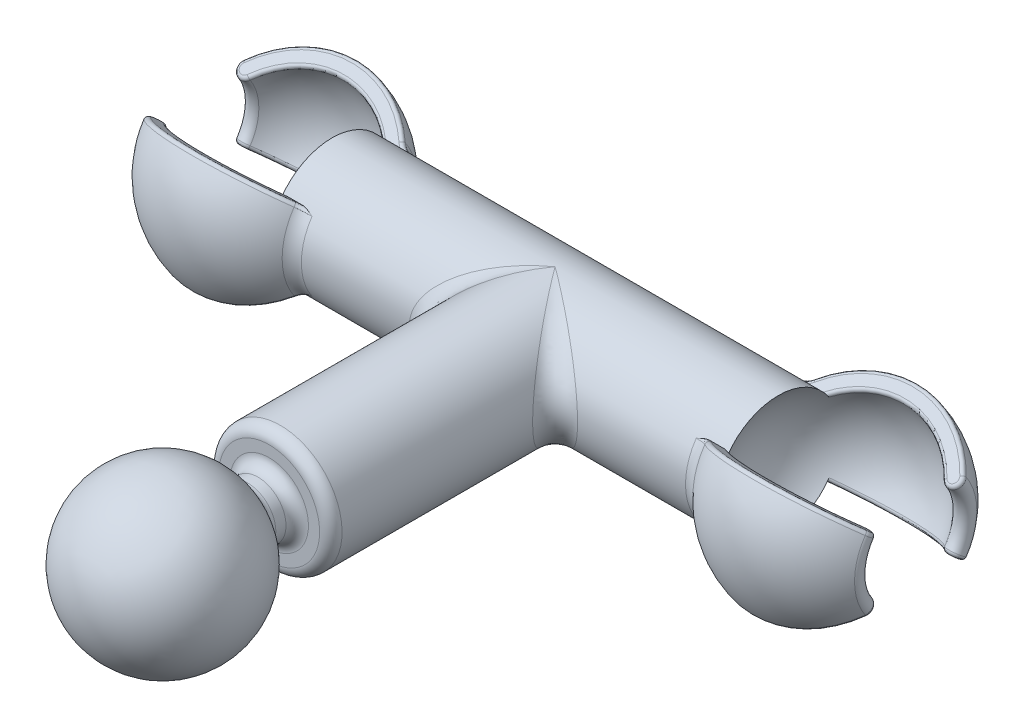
SolidWorks part; units mm, degrees
ref_plane "Front" through (0, 0, 0) normal (0, 0, 1) x (1, 0, 0)
ref_plane "Top" through (0, 0, 0) normal (0, 1, 0) x (1, 0, 0)
ref_plane "Right" through (0, 0, 0) normal (1, 0, 0) x (0, 0, -1)
sketch "Sketch1" plane through (0, 0, 0) normal (0, 0, 1) x (1, 0, 0)
  line L1 (9.525, 0) -> (31.75, 0)
  line L2 (31.75, 6.985) -> (31.75, 0)
  line L6 (6.4758, 6.985) -> (31.75, 6.985)
  line L7 (0, 0) -> (31.75, 0) construction
  arc A0 (6.4758, 6.985) -> (9.525, 0) centre (0, 0) cw
  dimension "D3" = 22.225
  dimension "D2" = 9.525
  dimension "D1" = 6.985
revolve "Revolve2" add sketch "Sketch1" angle 360 about L7
ref_plane "Plane3" through (31.75, 0, 0) normal (1, 0, 0) x (0, 0, -1)
sketch "Sketch2" plane through (31.75, 0, 31.75) normal (1, 0, 0) x (0, 0, -1)
  line L0 (31.75, 0) -> (31.75, 13.97) construction
  line L1 (-22.0472, 0) -> (31.75, 0)
  line L2 (-3.0581, 3.175) -> (-1.905, 3.175)
  line L3 (31.75, 6.985) -> (31.75, 0)
  line L4 (-0.635, 4.445) -> (-0.635, 5.715)
  line L6 (0.635, 6.985) -> (31.75, 6.985)
  line L7 (-12.7, 0) -> (76.1055, 0) construction
  line L8 (31.75, 50) -> (31.75, -50) construction
  line L9 (81.75, 0) -> (-18.25, 0) construction
  arc A0 (-4.2114, 3.9133) -> (-22.0472, 0) centre (-12.7, 0) ccw
  arc A2 (-3.0581, 3.175) -> (-4.2114, 3.9133) centre (-3.0581, 4.445) cw
  arc A3 (-1.905, 3.175) -> (-0.635, 4.445) centre (-1.905, 4.445) ccw
  arc A4 (-0.635, 5.715) -> (0.635, 6.985) centre (0.635, 5.715) cw
  point P16 (8.7914, 3.175)
  point P20 (12.065, 3.175)
  point P23 (12.065, 6.985)
  point P36 (31.75, 0)
  dimension "D3" = 1.27
  dimension "D6" = 12.065
  dimension "D1" = 9.3472
  dimension "D2" = 6.985
  dimension "D4" = 3.175
  dimension "D5" = 44.45
revolve "Revolve3" add sketch "Sketch2" angle 360 about L7
sketch "Sketch3" plane through (0, 0, 0) normal (0, 1, 0) x (1, 0, 0)
  line L0 (31.75, 6.985) -> (6.4758, 6.985) construction
  line L1 (6.4758, 6.985) -> (9.0474, 6.985)
  line L2 (0, 0) -> (25.7797, 0) construction
  arc A0 (6.4758, -6.985) -> (6.4758, 6.985) centre (0, 0) ccw construction
  arc A1 (6.4758, 6.985) -> (-7.5764, 5.7727) centre (0, 0) ccw
  arc A2 (9.0474, 6.985) -> (-9.0916, 6.9273) centre (0, 0) ccw
  arc A3 (-7.5764, 5.7727) -> (-9.0916, 6.9273) centre (-8.334, 6.35) cw
  dimension "D1" = 11.43
  dimension "D2" = 6.35
revolve "Revolve4" add sketch "Sketch3" angle 75 about L2
mirror "Mirror1" about plane through (0, 0, 0) normal (0, 0, 1) of "Revolve4"
fillet "Fillet5" radius 2.032 2 edges at (9.0474, 0, -6.985) (9.0474, 0, 6.985)
fillet "Fillet3" radius 0.381 16 edges at (9.1703, 4.3589, 5.6806) (-0.4734, 6.9522, 9.0602) (-8.9113, 3.4044, 4.4367) (9.1703, -4.3589, 5.6806) (-0.4734, -6.9522, 9.0602) (-8.9113, -3.4044, 4.4367) (9.1703, -4.3589, -5.6806) (-0.4734, -6.9522, -9.0602) (-8.9113, -3.4044, -4.4367) (9.1703, 4.3589, -5.6806) (-0.8187, 5.777, -7.5287) (-8.9113, 3.4044, -4.4367) (-0.8187, 5.777, 7.5287) (-0.8187, -5.777, 7.5287) (-0.8187, -5.777, -7.5287) (-0.4734, 6.9522, -9.0602)
mirror "Mirror2" about plane through (31.75, 6.985, 0) normal (-1, 0, 0) of "Fillet5", "Fillet3", "Revolve2", "Revolve4", "Mirror1"
fillet "Fillet4" radius 2.54 2 edges at (24.765, 0, 6.985) (38.735, 0, 6.985)
